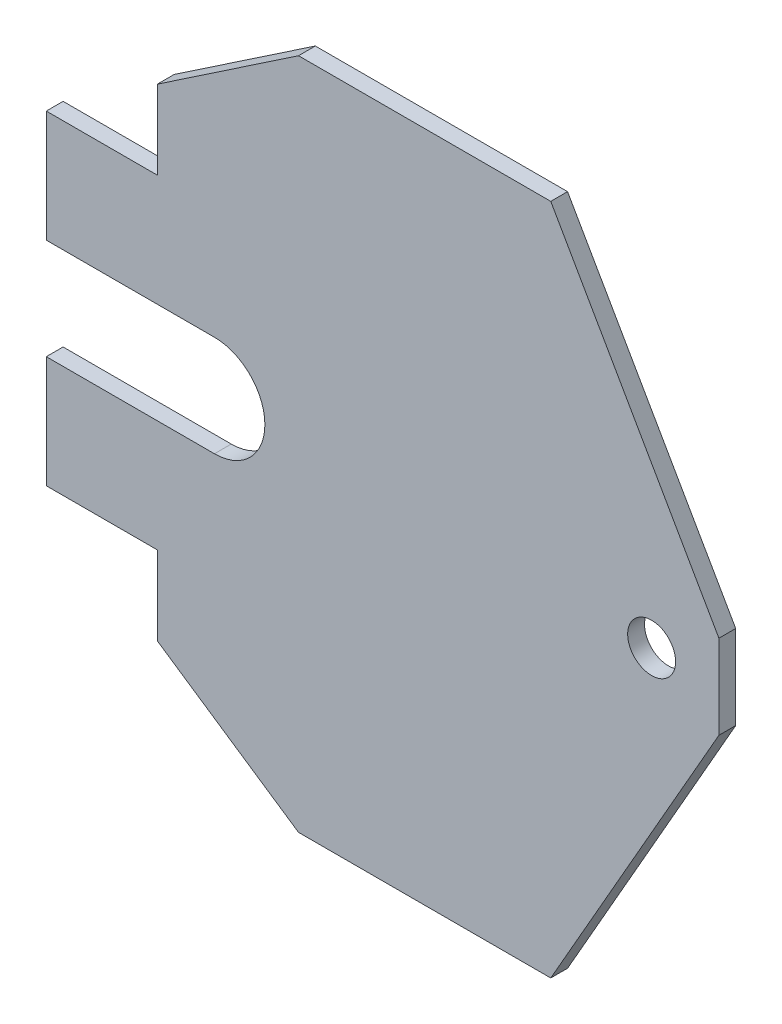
SolidWorks part; units mm, degrees
ref_plane "Face" through (0, 0, 0) normal (0, 0, 1) x (1, 0, 0)
ref_plane "Dessus" through (0, 0, 0) normal (0, 1, 0) x (1, 0, 0)
ref_plane "Droite" through (0, 0, 0) normal (1, 0, 0) x (0, 0, -1)
sketch "Esquisse1" plane through (0, 0, 0) normal (0, 0, 1) x (1, 0, 0)
  line L0 (40, 25) -> (40, -25)
  line L1 (-260, 30) -> (-360, 30)
  line L2 (-260, -30) -> (-360, -30)
  line L3 (-360, 96.5) -> (-360, 30)
  line L4 (-360, 96.5) -> (-294, 96.5)
  line L5 (-294, 96.5) -> (-294, 143.3413)
  line L6 (-210, 200) -> (-60, 200)
  line L7 (-60, 200) -> (40, 25)
  line L8 (-210, 200) -> (-294, 143.3413)
  line L9 (-360, -96.5) -> (-294, -96.5)
  line L10 (-294, -96.5) -> (-294, -143.3413)
  line L11 (-294, -143.3413) -> (-210, -200)
  line L12 (-210, -200) -> (-60, -200)
  line L13 (40, -25) -> (-60, -200)
  line L14 (-360, -30) -> (-360, -96.5)
  line L15 (-431.1677, 0) -> (211.525, 0) construction
  circle A0 centre (0, 0) radius 14.25
  arc A1 (-260, -30) -> (-260, 30) centre (-260, 0) ccw
  dimension "D8" = 400
  dimension "D9" = 100
  dimension "D5" = 30
  dimension "D18" = 28.5
  dimension "D1" = 400
  dimension "D2" = 50
  dimension "D3" = 66
  dimension "D11" = 150
  dimension "D12" = 150
  dimension "D13" = 100
  dimension "D14" = 100
  dimension "D15" = 40
  dimension "D16" = 146
  dimension "D17" = 193
  dimension "D19" = 146
extrude "Base-Extrusion" add sketch "Esquisse1" along normal blind 10
